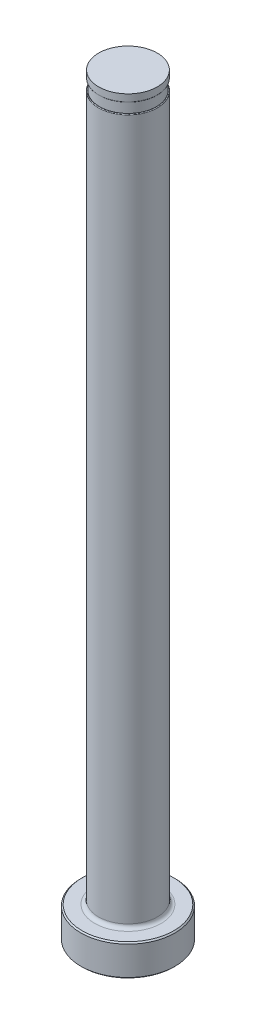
SolidWorks part; units mm, degrees
ref_plane "Front Plane" through (0, 0, 0) normal (0, 0, 1) x (1, 0, 0)
ref_plane "Top Plane" through (0, 0, 0) normal (0, 1, 0) x (1, 0, 0)
ref_plane "Right Plane" through (0, 0, 0) normal (1, 0, 0) x (0, 0, -1)
other "Configuration Table"
sketch "Sketch1" plane through (0, 0, 0) normal (0, 0, 1) x (1, 0, 0)
  line L0 (0, 259.9588) -> (0, -15.1925) construction
  line L1 (0, 0) -> (-9.525, 0)
  line L2 (-9.525, 0) -> (-9.525, 6.35)
  line L3 (-9.525, 6.35) -> (-5.9525, 6.35)
  line L4 (-5.9525, 6.35) -> (-5.9525, 152.4)
  line L5 (-5.9525, 152.4) -> (0, 152.4)
  line L6 (0, 152.4) -> (0, 0)
  dimension "L" = 152.4
  dimension "H" = 19.05
  dimension "T" = 6.35
  dimension "D" = 11.905
revolve "Revolve1" add sketch "Sketch1" angle 360 about L0
chamfer "Chamfer1" distance 0.254 angle 45 2 edges at (0, 6.35, 9.525) (0, 0, 9.525)
fillet "Fillet1" radius 0.762 1 edges at (0, 6.35, 5.9525)
sketch "Sketch2" plane through (0, 0, 0) normal (0, 0, 1) x (1, 0, 0)
  line L0 (-5.9525, 152.4) -> (-5.9525, 7.112) construction
  line L1 (-5.9525, 150.876) -> (-5.7493, 150.876)
  line L2 (-5.9525, 150.876) -> (-5.9525, 148.844)
  line L3 (-5.9525, 148.844) -> (-5.7493, 148.844)
  line L4 (-5.7493, 150.876) -> (-5.7493, 148.844)
  line L5 (5.9525, 152.4) -> (-5.9525, 152.4) construction
  line L6 (0, 153.4483) -> (0, 147.3282) construction
  dimension "D1" = 2.032
  dimension "N" = 1.524
  dimension "FD" = 0.2032
  dimension "D3" = 11.4986
revolve "Vent Relief" cut sketch "Sketch2" angle 360 about L6
sketch "Sketch3" plane through (0, 0, 0) normal (0, 0, 1) x (1, 0, 0)
  line L0 (-5.7493, 149.86) -> (-5.7493, 86.36)
  line L1 (-5.7493, 150.876) -> (-5.7493, 148.844) construction
  line L2 (-5.9525, 148.844) -> (-5.9525, 7.112) construction
  line L3 (-5.9525, 85.2424) -> (-5.9525, 149.86)
  line L4 (-5.9525, 149.86) -> (-5.7493, 149.86)
  arc A0 (-5.7493, 86.36) -> (-5.9525, 85.2424) centre (-8.9243, 86.36) cw
  dimension "D1" = 3.175
  dimension "D2" = 63.5
extrude "D-Slot" cut sketch "Sketch3" against normal through all both and the other way through all
sketch "Sketch5" plane through (0, 0, 0) normal (0, 0, 1) x (1, 0, 0)
  line L0 (-5.9525, 150.876) -> (5.9525, 150.876) construction
  line L1 (-5.9525, 152.4) -> (-5.9271, 152.4)
  line L2 (-5.9525, 152.4) -> (-5.9525, 150.876)
  line L3 (-5.9525, 150.876) -> (-5.9271, 150.876)
  line L4 (-5.9271, 152.4) -> (-5.9271, 150.876)
  line L5 (0, 152.6877) -> (0, 150.5771) construction
  dimension "VP" = 0.0254
revolve "Vent Diameter" cut sketch "Sketch5" angle 360 about L5
fillet "Fillet2" radius 0.127 2 edges at (5.9525, 148.844, 0) (0, 150.876, 5.9271)
sketch "Pocket Sketch" plane through (0, 0, 0) normal (0, 0, 1) x (1, 0, 0)
  line L0 (-9.9219, 0) -> (-9.9219, 6.3754)
  line L1 (-9.9219, 6.3754) -> (-6.9129, 6.3754)
  line L2 (-6.1509, 7.1374) -> (-6.1509, 22.225)
  line L3 (-6.1509, 22.225) -> (0, 22.225)
  line L4 (0, 22.225) -> (0, 0)
  line L5 (0, 0) -> (-9.9219, 0)
  line L6 (0, 12.6104) -> (0, -2.4989) construction
  line L7 (-9.525, 6.096) -> (-9.525, 0.254) construction
  line L8 (9.271, 6.35) -> (-9.271, 6.35) construction
  line L9 (-5.9525, 85.2424) -> (-5.9525, 7.112) construction
  line L10 (-6.9129, 6.3754) -> (-6.1509, 7.1374)
  point P3 (-6.1509, 6.3754)
  dimension "D1" = 19.8437
  dimension "D2" = 0.3969
  dimension "D3" = 0.0254
  dimension "D4" = 0.1984
  dimension "D5" = 12.3019
  dimension "D6" = 22.225
